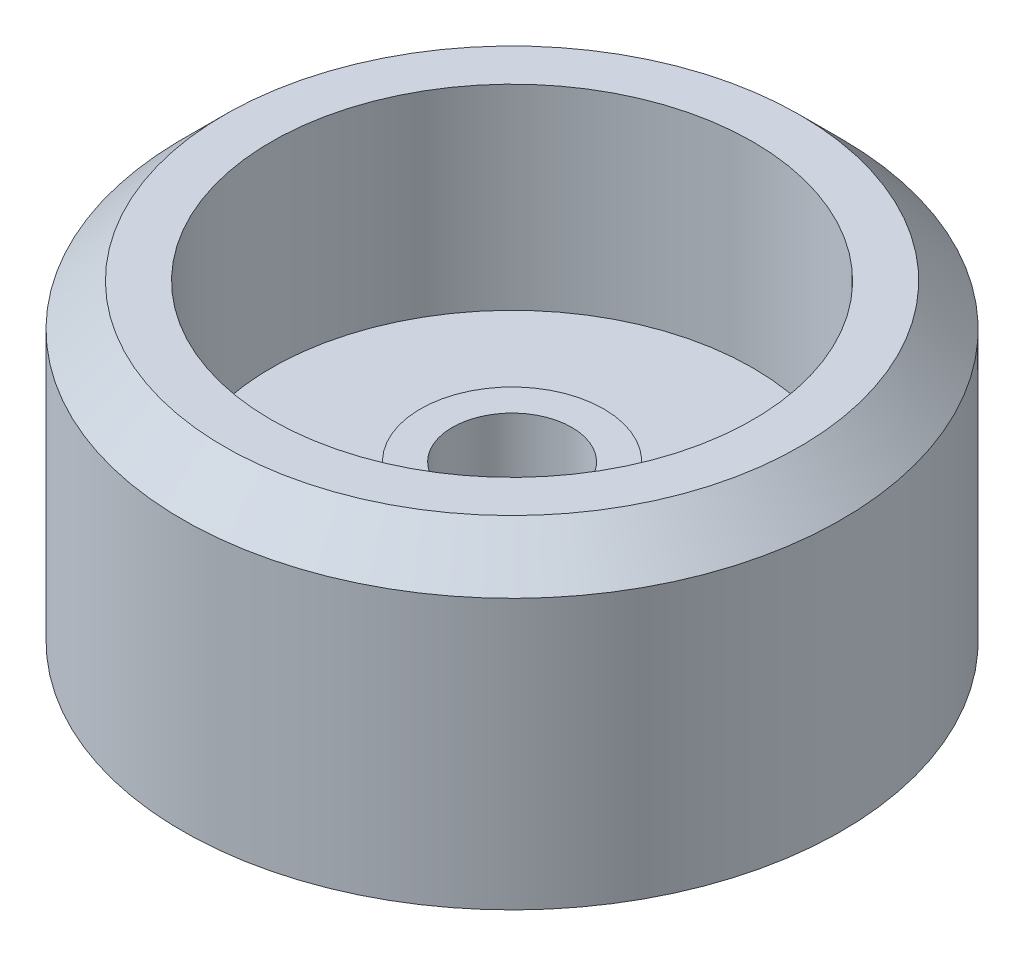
SolidWorks part; units mm, degrees
ref_plane "Plan de face" through (0, 0, 0) normal (0, 0, 1) x (1, 0, 0)
ref_plane "Plan de dessus" through (0, 0, 0) normal (0, 1, 0) x (1, 0, 0)
ref_plane "Plan de droite" through (0, 0, 0) normal (1, 0, 0) x (0, 0, -1)
sketch "Esquisse1" plane through (0, 0, 0) normal (0, 0, 1) x (1, 0, 0)
  line L0 (0, -39.4433) -> (0, 64.6514) construction
  line L1 (14.9726, -29.0635) -> (82.5896, -29.0635)
  line L2 (82.5896, -29.0635) -> (82.5896, 38.5536)
  line L3 (82.5896, 38.5536) -> (72.0616, 49.0817)
  line L4 (72.0616, 49.0817) -> (60.3472, 49.0817)
  line L5 (60.3472, 49.0817) -> (60.3472, 0)
  line L6 (60.3472, 0) -> (22.9799, 0)
  line L7 (22.9799, 0) -> (22.9799, 9.7867)
  line L8 (22.9799, 9.7867) -> (14.9726, 9.7867)
  line L9 (14.9726, 9.7867) -> (14.9726, -29.0635)
revolve "Révolution1" add sketch "Esquisse1" angle 360 about L0
